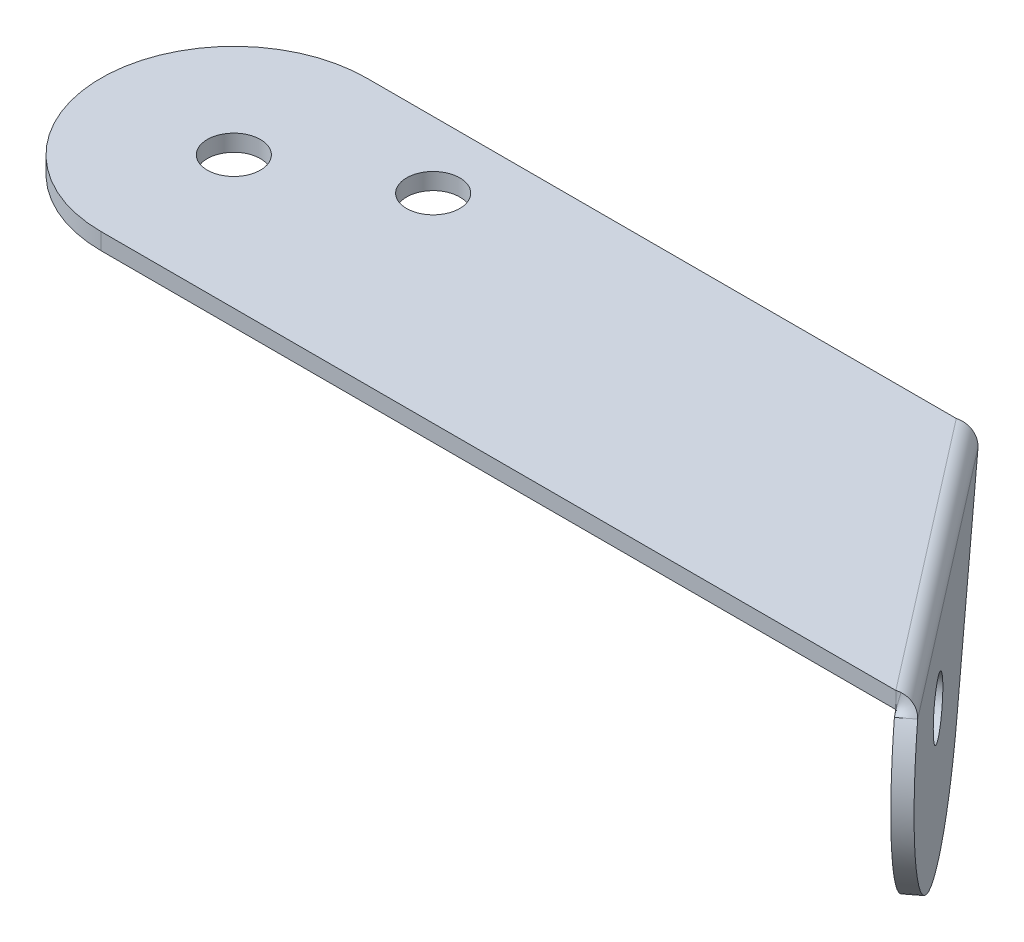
SolidWorks part; units mm, degrees
ref_plane "Front" through (0, 0, 0) normal (0, 0, 1) x (1, 0, 0)
ref_plane "Top" through (0, 0, 0) normal (0, 1, 0) x (1, 0, 0)
ref_plane "Right" through (0, 0, 0) normal (1, 0, 0) x (0, 0, -1)
sketch "Sketch1" plane through (0, 0, 0) normal (0, 1, 0) x (1, 0, 0)
  line L1 (48, 8) -> (0, 8)
  line L2 (0, -8) -> (48, -8)
  arc A0 (48, -8) -> (48, 8) centre (48, 0) ccw
  arc A1 (0, 8) -> (0, -8) centre (0, 0) ccw
  circle A2 centre (48, 0) radius 1.6
  circle A3 centre (0, 0) radius 1.6
  circle A4 centre (8, 4) radius 1.6
  dimension "D2" = 4
  dimension "D3" = 8
  dimension "D4" = 8
  dimension "D1" = 48
sheet metal parameters "Sheet-Metal1" thickness 1 parameters "D1"=0.01
base flange "Base-Flange1" sketch "Sketch1" thickness 1 reverse thickness direction yes parameters "D1"=0.01
sketch "Sketch3" plane through (0, 1, 0) normal (0, 1, 0) x (-1, 0, 0)
  line L2 (-48, 7.5358) -> (-36, -8)
sketched bend "Sketched Bend1" parameters "D1"=0.01
bend "SketchBend1" bend radius 0.01 bend angle 90 parameters "D5"=1
flat pattern "Flat-Pattern1"
sketch "Bend-Lines1" plane through (0, 1, 0) normal (0, 1, 0) x (-1, 0, 0)
  line L0 (-36, -8) -> (-48.3526, 7.9922) construction
bend of the flat pattern "Flatten-<SketchBend1>1"
